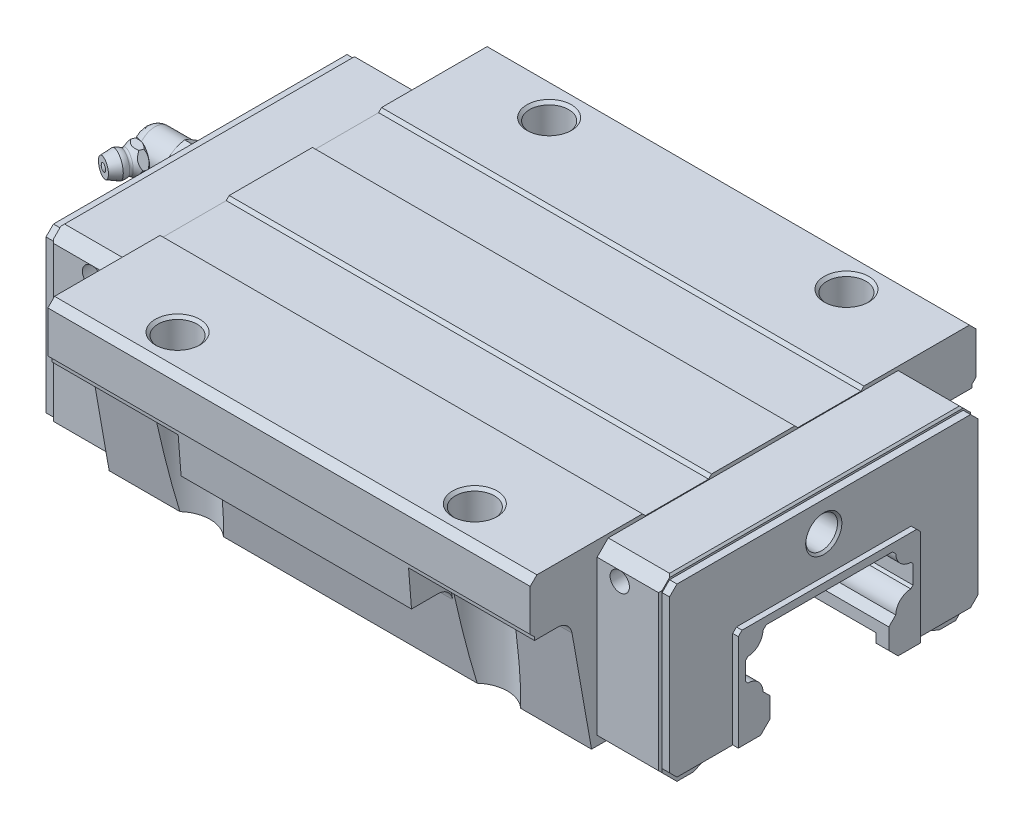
SolidWorks part; units mm, degrees
ref_plane "Front Plane" through (0, 0, 0) normal (0, 0, 1) x (1, 0, 0)
ref_plane "Top Plane" through (0, 0, 0) normal (0, 1, 0) x (1, 0, 0)
ref_plane "Right Plane" through (0, 0, 0) normal (1, 0, 0) x (0, 0, -1)
imported_body "HSR45LC1SS-570L_G22-5_0_B-PT18_199-6_0_0_0_1.stp-1/_HSR45LCSSB-PT1_81 Slider-1.stp-1-solid1"
imported_body "HSR45LC1SS-570L_G22-5_0_B-PT18_199-6_0_0_0_1.stp-1/_hsr_ftht_B-PT1_8_grease_nipple_joint.stp-1-solid1"
move or copy body "Body-Move/Copy1" bodies to move or copy 104 103 copy no translate (-262.5, 0, 0)
